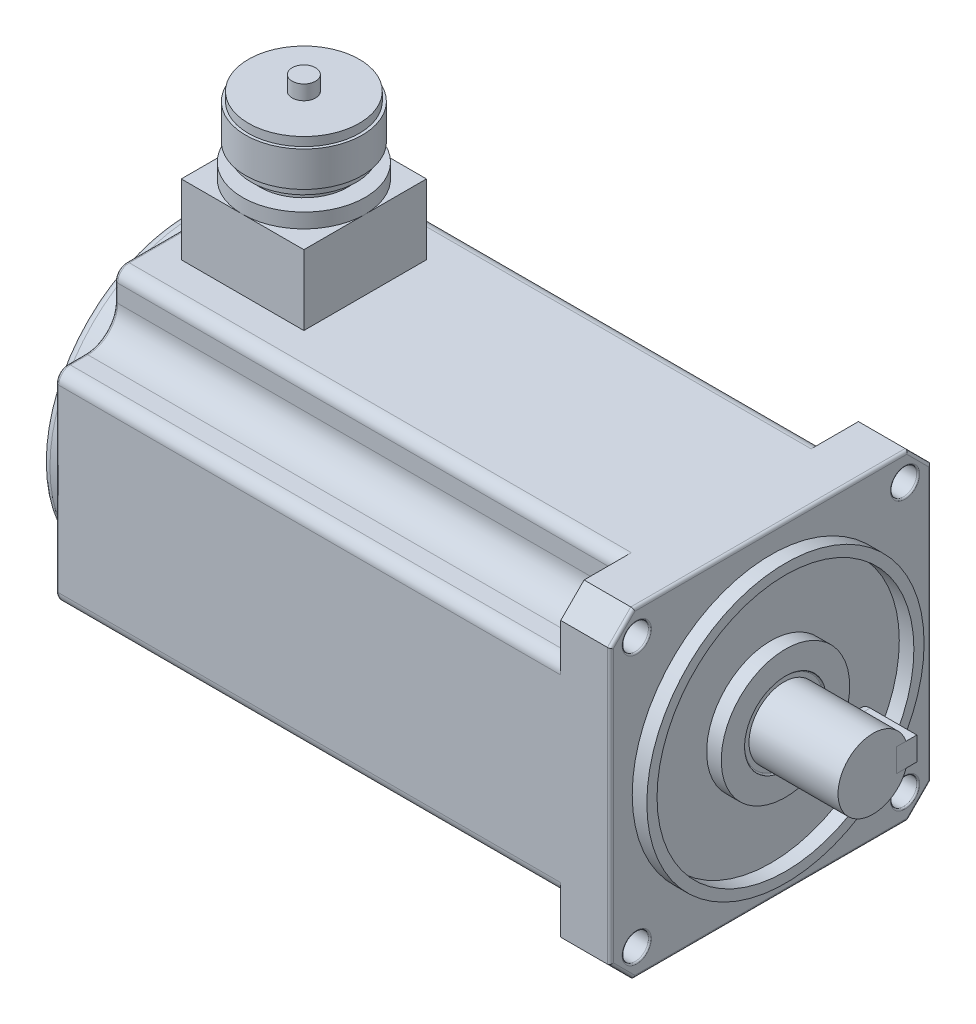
SolidWorks part; units mm, degrees
ref_plane "前视基准面" through (0, 0, 0) normal (0, 0, 1) x (1, 0, 0)
ref_plane "上视基准面" through (0, 0, 0) normal (0, 1, 0) x (1, 0, 0)
ref_plane "右视基准面" through (0, 0, 0) normal (1, 0, 0) x (0, 0, -1)
sketch "草图1" plane through (0, 0, 0) normal (1, 0, 0) x (0, 0, -1)
  line L0 (-55, 47) -> (-47, 55)
  line L1 (-47, -55) -> (47, -55)
  line L2 (-55, -47) -> (-55, 47)
  line L3 (-47, 55) -> (47, 55)
  line L4 (55, -47) -> (55, 47)
  line L5 (-55, -55) -> (55, 55) construction
  line L6 (-55, 55) -> (55, -55) construction
  line L7 (47, 55) -> (55, 47)
  line L8 (47, -55) -> (55, -47)
  line L9 (-55, -47) -> (-47, -55)
  point P0 (0, 0)
extrude "凸台-拉伸1" add sketch "草图1" against normal blind 190
sketch "草图2" plane through (-190, 0, 0) normal (-1, 0, 0) x (0, 0, 1)
  line L0 (-45, 34.802) -> (-51, 34.802)
  line L1 (-55, -47) -> (-55, 47) construction
  line L2 (-30.802, 55) -> (-47, 55)
  line L3 (-51, -34.802) -> (-45, -34.802)
  line L4 (-47, 55) -> (-55, 47)
  line L5 (-34.802, -45) -> (-34.802, -51)
  line L6 (47, -55) -> (-47, -55) construction
  line L7 (-55, 47) -> (-55, 30.802)
  line L8 (34.802, -51) -> (34.802, -45)
  line L9 (-55, -30.802) -> (-55, -47)
  line L10 (45, -34.802) -> (51, -34.802)
  line L11 (55, 47) -> (55, -47) construction
  line L12 (-55, -47) -> (-47, -55)
  line L13 (51, 34.802) -> (45, 34.802)
  line L14 (-47, -55) -> (-30.802, -55)
  line L15 (34.802, 45) -> (34.802, 51)
  line L16 (-47, 55) -> (47, 55) construction
  line L17 (30.802, -55) -> (47, -55)
  line L18 (-34.802, 51) -> (-34.802, 45)
  line L19 (47, -55) -> (55, -47)
  line L20 (55, -47) -> (55, -30.802)
  line L21 (55, 30.802) -> (55, 47)
  line L22 (55, 47) -> (47, 55)
  line L23 (47, 55) -> (30.802, 55)
  arc A0 (-45, 34.802) -> (-34.802, 45) centre (-45, 45) ccw
  arc A1 (34.802, 45) -> (45, 34.802) centre (45, 45) ccw
  arc A2 (45, -34.802) -> (34.802, -45) centre (45, -45) ccw
  arc A3 (-34.802, -45) -> (-45, -34.802) centre (-45, -45) ccw
  arc A4 (-55, -30.802) -> (-51, -34.802) centre (-51, -30.802) ccw
  arc A5 (-34.802, -51) -> (-30.802, -55) centre (-30.802, -51) ccw
  arc A6 (30.802, -55) -> (34.802, -51) centre (30.802, -51) ccw
  arc A7 (55, -30.802) -> (51, -34.802) centre (51, -30.802) cw
  arc A8 (55, 30.802) -> (51, 34.802) centre (51, 30.802) ccw
  arc A9 (34.802, 51) -> (30.802, 55) centre (30.802, 51) ccw
  arc A10 (-30.802, 55) -> (-34.802, 51) centre (-30.802, 51) ccw
  arc A11 (-55, 30.802) -> (-51, 34.802) centre (-51, 30.802) cw
  point P10 (-55, -34.802)
  point P38 (-34.802, -55)
  point P41 (34.802, -55)
  point P44 (55, -34.802)
  point P47 (55, 34.802)
  point P50 (34.802, 55)
  point P53 (-34.802, 55)
  point P56 (-55, 34.802)
  dimension "D1" = 4
extrude "切除-拉伸1" cut sketch "草图2" against normal blind 173
sketch "草图3" plane through (0, 0, 0) normal (1, 0, 0) x (0, 0, -1)
  circle A1 centre (-45.9619, 45.9619) radius 4.5
  circle A2 centre (45.9619, 45.9619) radius 4.5
  circle A3 centre (45.9619, -45.9619) radius 4.5
  circle A4 centre (-45.9619, -45.9619) radius 4.5
extrude "切除-拉伸2" cut sketch "草图3" against normal blind 17
fillet "圆角1" radius 1 24 edges at (-190, 37.7889, 37.7889) (-190, 34.802, 48) (-190, 33.6304, 53.8284) (-190, 0, 55) (-190, -33.6304, 53.8284) (-190, -34.802, 48) (-190, -37.7889, 37.7889) (-190, -48, 34.802) (-190, -53.8284, 33.6304) (-190, -55, 0) (-190, -53.8284, -33.6304) (-190, -48, -34.802) (-190, -37.7889, -37.7889) (-190, -34.802, -48) (-190, -33.6304, -53.8284) (-190, 0, -55) (-190, 33.6304, -53.8284) (-190, 34.802, -48) (-190, 37.7889, -37.7889) (-190, 48, -34.802) (-190, 53.8284, -33.6304) (-190, 55, 0) (-190, 53.8284, 33.6304) (-190, 48, 34.802)
fillet "圆角2" radius 1 8 edges at (0, 51, -51) (0, -51, -51) (0, 0, -55) (0, -55, 0) (0, -51, 51) (0, 0, 55) (0, 51, 51) (0, 55, 0)
fillet "圆角3" radius 0.5 4 edges at (0, -45.9619, 41.4619) (0, -45.9619, -50.4619) (0, 45.9619, -50.4619) (0, 45.9619, 41.4619)
sketch "草图4" plane through (-190, 0, 0) normal (-1, 0, 0) x (0, 0, 1)
  circle A0 centre (0, 0) radius 50
extrude "凸台-拉伸2" add sketch "草图4" along normal blind 10
fillet "圆角4" radius 3 1 edges at (-200, 0, 50)
sketch "草图5" plane through (0, 0, 0) normal (1, 0, 0) x (0, 0, -1)
  circle A0 centre (0, 0) radius 47.5
  circle A1 centre (0, 0) radius 44
extrude "凸台-拉伸3" add sketch "草图5" along normal blind 5
sketch "草图6" plane through (0, 0, 0) normal (1, 0, 0) x (0, 0, -1)
  circle A0 centre (0, 0) radius 22
extrude "凸台-拉伸4" add sketch "草图6" along normal blind 5
sketch "草图7" plane through (5, 0, 0) normal (1, 0, 0) x (0, 0, -1)
  circle A0 centre (0, 0) radius 14
extrude "切除-拉伸3" cut sketch "草图7" against normal blind 0.5
fillet "圆角5" radius 0.5 1 edges at (4.5, 0, -14)
sketch "草图8" plane through (4.5, 0, 0) normal (1, 0, 0) x (0, 0, -1)
  circle A0 centre (0, 0) radius 12
extrude "凸台-拉伸5" add sketch "草图8" along normal blind 30.5
ref_plane "基准面1" through (0, 0, -12) normal (0, 0, 1) x (1, 0, 0)
sketch "草图9" plane through (0, 0, -12) normal (0, 0, 1) x (1, 0, 0)
  line L1 (35, -12) -> (35, 12) construction
  line L2 (19, 4) -> (35, 4)
  line L3 (35, 4) -> (35, -4)
  line L4 (35, -4) -> (19, -4)
  arc A0 (19, 4) -> (19, -4) centre (19, 0) ccw
extrude "切除-拉伸5" cut sketch "草图9" along normal blind 4
sketch "草图10" plane through (0, 0, -8) normal (0, 0, -1) x (-1, 0, 0)
  line L0 (-19, 4) -> (-35, 4)
  line L1 (-35, 4) -> (-35, -4)
  line L2 (-35, -4) -> (-19, -4)
  arc A0 (-19, -4) -> (-19, 4) centre (-19, 0) ccw
extrude "凸台-拉伸6" add sketch "草图10" along normal blind 7 separate body
sketch "草图11" plane through (0, 55, 0) normal (0, 1, 0) x (1, 0, 0)
  line L3 (-181, -21) -> (-139, -21)
  line L4 (-181, -21) -> (-181, 21)
  line L5 (-181, 21) -> (-139, 21)
  line L6 (-139, -21) -> (-139, 21)
  line L7 (-181, -21) -> (-139, 21) construction
  line L8 (-181, 21) -> (-139, -21) construction
extrude "凸台-拉伸7" add sketch "草图11" along normal blind 24
sketch "草图12" plane through (0, 79, 0) normal (0, 1, 0) x (1, 0, 0)
  circle A0 centre (-160, 0) radius 21
extrude "凸台-拉伸8" add sketch "草图12" along normal blind 5
sketch "草图13" plane through (0, 84, 0) normal (0, 1, 0) x (1, 0, 0)
  circle A0 centre (-160, 0) radius 15
extrude "凸台-拉伸9" add sketch "草图13" along normal blind 3
sketch "草图14" plane through (0, 87, 0) normal (0, 1, 0) x (1, 0, 0)
  circle A0 centre (-160, 0) radius 18
extrude "凸台-拉伸10" add sketch "草图14" along normal blind 3
sketch "草图15" plane through (0, 90, 0) normal (0, 1, 0) x (1, 0, 0)
  circle A0 centre (-160, 0) radius 20
extrude "凸台-拉伸11" add sketch "草图15" along normal blind 12
sketch "草图16" plane through (0, 102, 0) normal (0, 1, 0) x (1, 0, 0)
  circle A0 centre (-160, 0) radius 19
extrude "凸台-拉伸12" add sketch "草图16" along normal blind 3
sketch "草图17" plane through (0, 105, 0) normal (0, 1, 0) x (1, 0, 0)
  circle A0 centre (-160, 0) radius 4
extrude "凸台-拉伸13" add sketch "草图17" along normal blind 5
